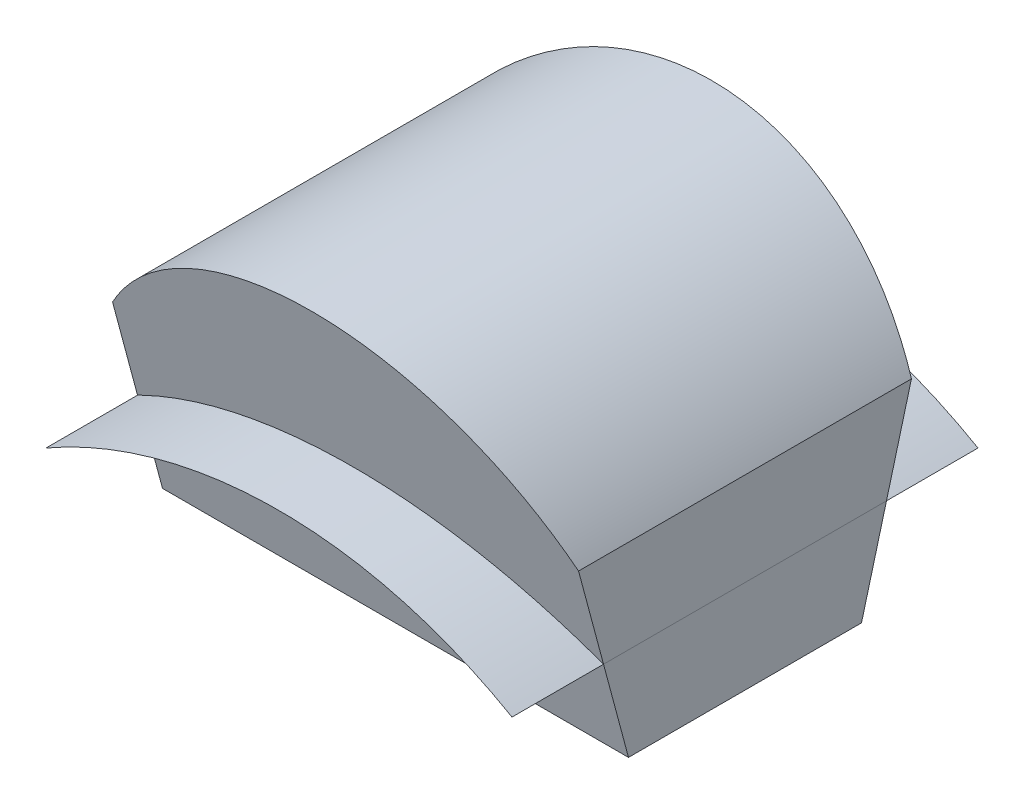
SolidWorks part; units mm, degrees
ref_plane "Płaszczyzna przednia" through (0, 0, 0) normal (0, 0, 1) x (1, 0, 0)
ref_plane "Płaszczyzna górna" through (0, 0, 0) normal (0, 1, 0) x (1, 0, 0)
ref_plane "Płaszczyzna prawa" through (0, 0, 0) normal (1, 0, 0) x (0, 0, -1)
sketch "Szkic1" plane through (0, 0, 0) normal (0, 0, 1) x (1, 0, 0)
  line L0 (-50, 0) -> (50, 0)
  line L1 (50, 0) -> (50, 40)
  line L2 (-50, 0) -> (-50, 40)
  arc A0 (-50, 40) -> (50, 40) centre (0, 6.8338) cw
  dimension "D3" = 60
  dimension "D1" = 100
  dimension "D2" = 40
extrude "Dodanie-wyciągnięcie1" add sketch "Szkic1" along normal mid plane 50
draft "Pochylenie1" type of draft neutral plane draft angle 15 faces to draft 2 parameters "D1"=15
shell "Skorupa1" thickness 2
surface "Powierzchnia-Odsunięcie1" parameters "D1"=1
sketch "Szkic2" plane through (0, 0, 0) normal (0, 0, 1) x (1, 0, 0)
  line L0 (-50, 40) -> (-50, 0) construction
  line L1 (50, 0) -> (50, 40) construction
  line L3 (-50, 0) -> (50, 0) construction
  arc A0 (-50, 20) -> (50, 20) centre (0, -66.6025) cw
  point P3 (0, 0)
  dimension "D1" = 100
  dimension "D2" = 20
surface "Powierzchnia-Wyciągnięcie1" sketch "Szkic2" parameters "D1"=100
surface "Powierzchnia-Odsunięcie2" parameters "D1"=1
surface "Powierzchnia-Przytnij1"
surface "Powierzchnia-Przytnij2"
surface "Powierzchnia-Przytnij3"
surface "Powierzchnia-Przytnij4"
surface "Powierzchnia-Połącz1"
split "Podziel1" trimming surface bodies 109 bodies to split 101 resulting bodies 110 111
